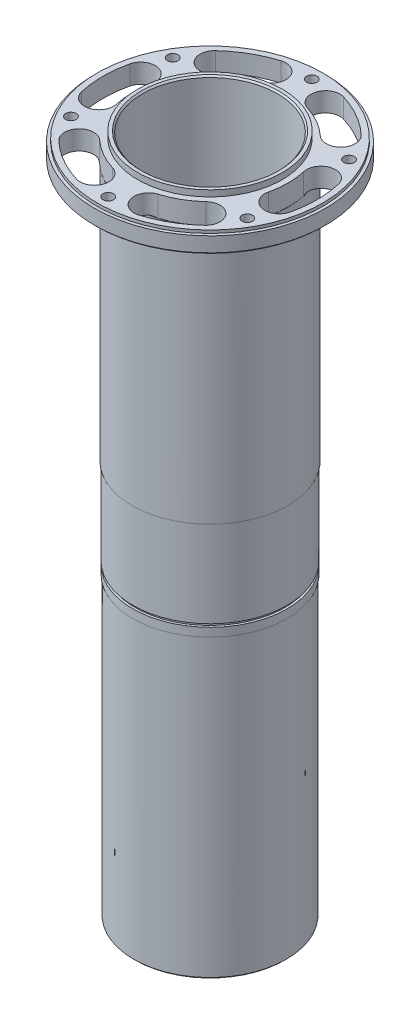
SolidWorks part; units mm, degrees
ref_plane "Front Plane" through (0, 0, 0) normal (0, 0, 1) x (1, 0, 0)
ref_plane "Top Plane" through (0, 0, 0) normal (0, 1, 0) x (1, 0, 0)
ref_plane "Right Plane" through (0, 0, 0) normal (1, 0, 0) x (0, 0, -1)
sketch "Sketch1" plane through (0, 0, 0) normal (0, 0, 1) x (1, 0, 0)
  line L0 (0, 0) -> (0, 40.0271) construction
  line L1 (-23.8125, 0) -> (-37.1348, 0)
  line L2 (-37.1348, 0) -> (-37.1348, -0.9906)
  line L3 (-25.654, -6.35) -> (-38.1, -6.35)
  line L4 (-37.1348, -0.9906) -> (-38.1, -0.9906)
  line L5 (-23.8125, 0) -> (-23.8125, 2.032)
  line L6 (-23.8125, 2.032) -> (-22.225, 2.032)
  line L7 (-22.225, 2.032) -> (-22.225, -222.25)
  line L8 (-22.225, -222.25) -> (-25.146, -222.25)
  line L9 (-25.146, -222.25) -> (-25.146, -124.46)
  line L10 (-25.4, -121.6406) -> (-24.6761, -121.6406)
  line L11 (-24.6761, -121.6406) -> (-24.6761, -120.65)
  line L12 (-24.6761, -120.65) -> (-25.4, -120.65)
  line L13 (-25.146, -124.46) -> (-25.4, -124.46)
  line L14 (-25.4, -124.46) -> (-25.4, -121.6406)
  line L15 (-25.4, -120.65) -> (-25.4, -92.075)
  line L16 (-25.4, -92.075) -> (-25.654, -92.075)
  line L19 (-25.654, -92.075) -> (-25.654, -6.35)
  line L20 (-38.1, -0.9906) -> (-38.1, -6.35)
  dimension "D2" = 6.35
  dimension "D3" = 44.45
  dimension "D4" = 47.625
  dimension "D5" = 2.032
  dimension "D6" = 50.8
  dimension "D7" = 28.575
  dimension "D8" = 50.292
  dimension "D9" = 120.65
  dimension "D10" = 222.25
  dimension "D11" = 51.308
  dimension "D12" = 124.46
  dimension "D13" = 0.9906
  dimension "D14" = 76.2
  dimension "D15" = 49.3522
  dimension "D16" = 0.9906
  dimension "D17" = 74.2696
revolve "Revolve1" add sketch "Sketch1" angle 360 about L0
hole_wizard "#8-32 Tapped Hole1" positions "Sketch8" profile "Sketch7" tap size "#8-32" standard "ANSI Inch"
sketch "Sketch8" plane through (0, 0, 0) normal (0, 1, 0) x (1, 0, 0)
  line L0 (0, -28.575) -> (0, 0) construction
  point P0 (0, -28.575)
  dimension "D1" = 28.575
sketch "Sketch7" plane through (0, 0, 28.575) normal (1, 0, 0) x (0, 0, 1)
  line L0 (0, 0) -> (0, 12.446)
  line L1 (0, 12.446) -> (1.7272, 12.446)
  line L2 (1.7272, 12.446) -> (1.7272, 0)
  line L5 (1.7272, 0) -> (0, 0)
  line L10 (0, 12.446) -> (-1.7272, 12.446) construction
  line L11 (0, -6.35) -> (0, 107.95) construction
  dimension "Tap Drill Dia." = 3.4544
  dimension "Tap Drill Depth" = 12.446
  dimension "Drill Angle" = 180
hole_wizard "#8-32 Tapped Hole2" positions "Sketch10" profile "Sketch9" tap size "#8-32" standard "ANSI Inch"
sketch "Sketch10" plane through (0, 0, 0) normal (0, 1, 0) x (1, 0, 0)
  line L0 (0, -39.37) -> (0, 0) construction
  line L1 (0, 0) -> (29.0361, -16.764) construction
  point P0 (29.0361, -16.764)
  dimension "D1" = 33.528
  dimension "D2" = 60
sketch "Sketch9" plane through (29.0361, 0, 16.764) normal (1, 0, 0) x (0, 0, 1)
  line L0 (0, 0) -> (0, 10.668)
  line L1 (0, 10.668) -> (1.7272, 10.668)
  line L2 (1.7272, 10.668) -> (1.7272, 0)
  line L5 (1.7272, 0) -> (0, 0)
  line L10 (0, 10.668) -> (-1.7272, 10.668) construction
  line L11 (0, -6.35) -> (0, 107.95) construction
  dimension "Tap Drill Dia." = 3.4544
  dimension "Tap Drill Depth" = 10.668
  dimension "Drill Angle" = 180
fillet "Fillet1" radius 0.762 1 edges at (0, -6.35, -25.654)
sketch "Sketch11" plane through (0, 0, 0) normal (0, 1, 0) x (1, 0, 0)
  line L0 (20.7873, -22.2917) -> (0, 0) construction
  line L1 (0, 0) -> (8.9115, -29.1482) construction
  line L2 (0, 0) -> (0, -42.7723) construction
  line L3 (0, 0) -> (29.0361, -16.764) construction
  line L4 (0, -30.48) -> (26.3965, -15.24) construction
  line L5 (17.6276, -30.5319) -> (13.1982, -22.86) construction
  arc A0 (24.044, -25.784) -> (17.5306, -18.7993) centre (20.7873, -22.2917) ccw
  arc A1 (10.3076, -33.7147) -> (24.044, -25.784) centre (0, 0) ccw
  circle A2 centre (0, 0) radius 30.48 construction
  arc A3 (7.5154, -24.5816) -> (10.3076, -33.7147) centre (8.9115, -29.1482) ccw
  arc A4 (7.5154, -24.5816) -> (17.5306, -18.7993) centre (0, 0) ccw
  dimension "D1" = 4.7752
  dimension "D2" = 60.96
  dimension "D4" = 26
extrude "Cut-Extrude1" cut sketch "Sketch11" against normal up to next
pattern_circular "CirPattern1" count 6 over 360 about axis through (0, 0, 0) along (0, 1, 0) of "#8-32 Tapped Hole2"
pattern_circular "CirPattern2" count 6 over 360 about axis through (0, 0, 0) along (0, 1, 0) of "Cut-Extrude1"
chamfer "Chamfer1" distance 0.508 angle 45 4 edges at (0, -6.35, -38.1) (0, 2.032, -22.225) (0, -222.25, -22.225) (0, -222.25, -25.146)
